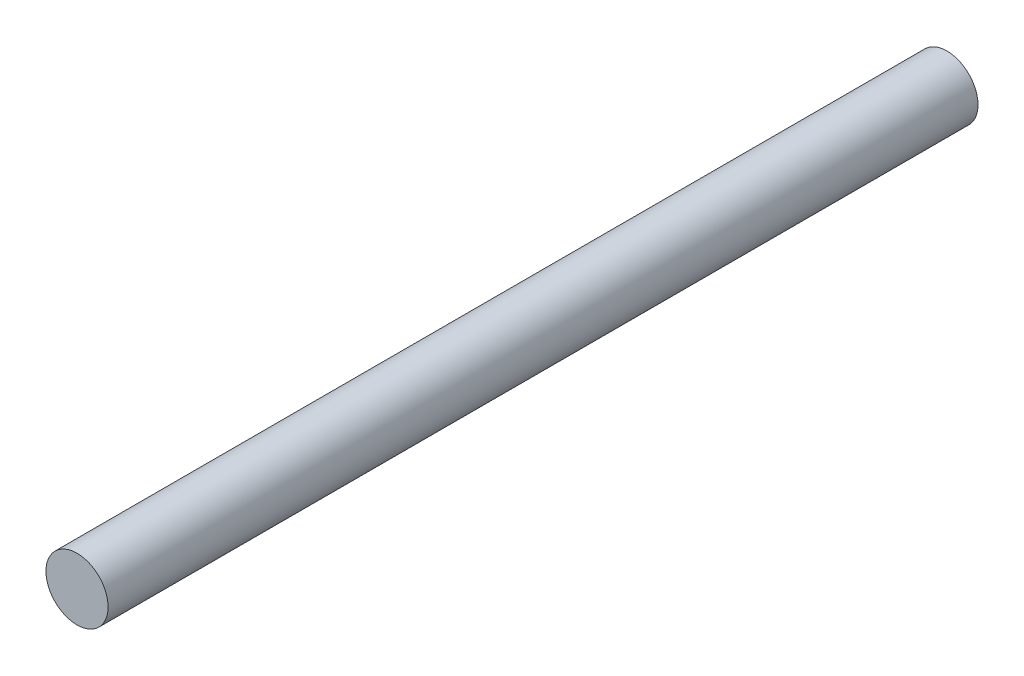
SolidWorks part; units mm, degrees
ref_plane "Front Plane" through (0, 0, 0) normal (0, 0, 1) x (1, 0, 0)
ref_plane "Top Plane" through (0, 0, 0) normal (0, 1, 0) x (1, 0, 0)
ref_plane "Right Plane" through (0, 0, 0) normal (1, 0, 0) x (0, 0, -1)
sketch "Sketch1" plane through (0, 0, 0) normal (0, 0, 1) x (1, 0, 0)
  circle A0 centre (0, 0) radius 14.2875
  dimension "D1" = 28.575
extrude "Boss-Extrude1" add sketch "Sketch1" along normal blind 400 contours A0
